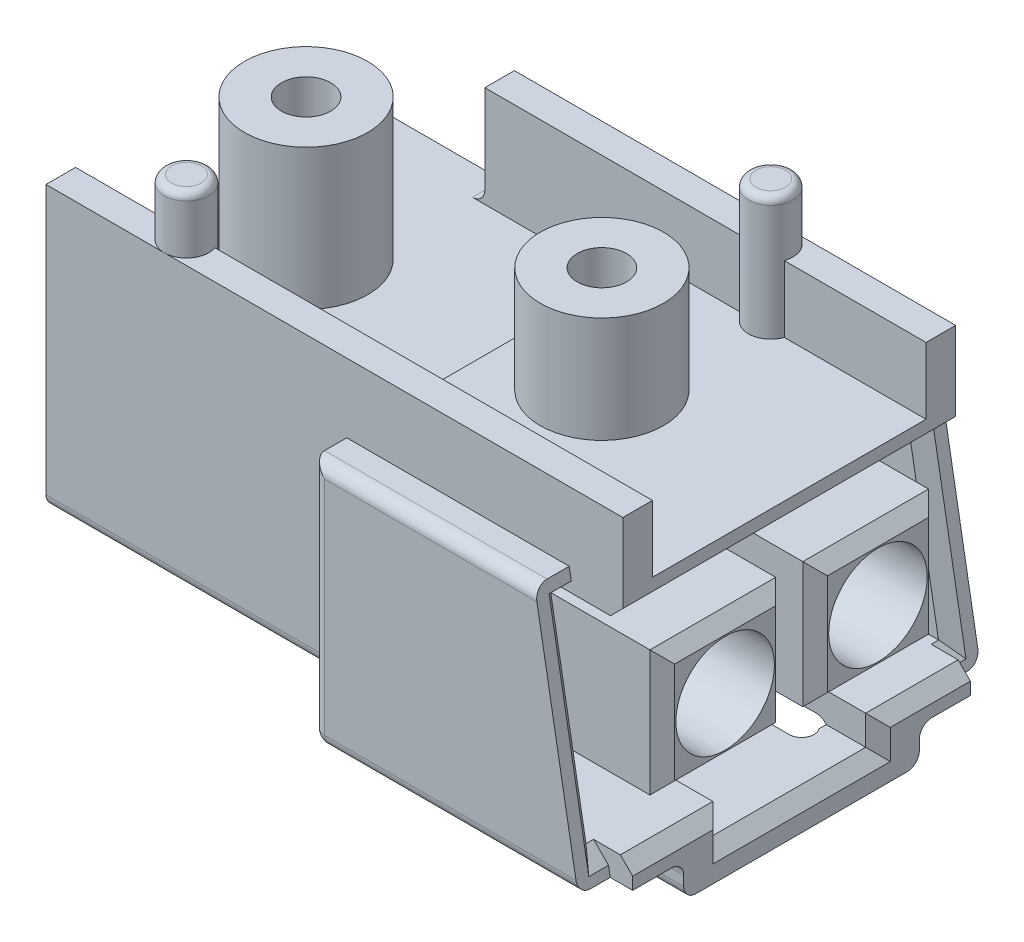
SolidWorks part; units mm, degrees
ref_plane "Front Plane" through (0, 0, 0) normal (0, 0, 1) x (1, 0, 0)
ref_plane "Top Plane" through (0, 0, 0) normal (0, 1, 0) x (1, 0, 0)
ref_plane "Right Plane" through (0, 0, 0) normal (1, 0, 0) x (0, 0, -1)
sketch "Sketch1" plane through (0, 0, 0) normal (0, 0, 1) x (1, 0, 0)
  line L0 (7.1, 7.7) -> (7.1, 0)
  line L1 (-7.1, 7.3) -> (5.1, 7.3)
  line L2 (-7.1, 7.3) -> (-7.1, 0)
  line L3 (7.1, 0) -> (-7.1, 0)
  line L4 (16.3, 7.7) -> (7.1, 7.7)
  line L5 (5.1, 8.7) -> (16.3, 8.7)
  line L6 (16.3, 8.7) -> (16.3, 7.7)
  line L7 (5.1, 8.7) -> (5.1, 7.3)
  dimension "D1" = 14.2
  dimension "D2" = 7.3
  dimension "D3" = 7.7
  dimension "D4" = 1.4
  dimension "D5" = 12.2
  dimension "D6" = 11.2
extrude "Extrude1" add sketch "Sketch1" against normal blind 6.75
chamfer "Chamfer1" distance 0.5 angle 45 1 edges at (16.3, 7.7, -3.375)
sketch "Sketch2" plane through (7.1, 0, 0) normal (1, 0, 0) x (0, 0, -1)
  line L0 (5.65, 6.2) -> (0.55, 6.2)
  line L1 (5.65, 1.1) -> (5.65, 6.2)
  line L2 (0.55, 1.1) -> (5.65, 1.1)
  line L3 (0.55, 6.2) -> (0.55, 1.1)
  line L4 (0, 0) -> (0, 7.7) construction
  line L5 (6.75, 7.7) -> (0, 7.7) construction
  dimension "D1" = 5.1
  dimension "D2" = 5.1
  dimension "D3" = 0.55
  dimension "D4" = 1.5
extrude "Extrude2" add sketch "Sketch2" along normal blind 9.7
chamfer "Chamfer2" distance 0.5 angle 45 4 edges at (16.8, 1.1, -3.1) (16.8, 3.65, -5.65) (16.8, 6.2, -3.1) (16.8, 3.65, -0.55)
ref_plane "Plane1" through (0, 0, -3.1) normal (0, 0, 1) x (1, 0, 0)
sketch "Sketch4" plane through (0, 0, -3.1) normal (0, 0, 1) x (1, 0, 0)
  line L0 (-7.1, 3.65) -> (16.8, 3.65) construction
  line L1 (-7.1, 0.95) -> (2.35, 0.95)
  line L2 (2.35, 0.95) -> (3.4, 2)
  line L3 (5.8, 2.085) -> (6.05, 2.335)
  line L4 (3.4, 2) -> (5.8, 2)
  line L5 (6.05, 2.335) -> (7.95, 2.335)
  line L6 (7.95, 1.65) -> (7.95, 2.335)
  line L7 (7.95, 1.65) -> (16.8, 1.65)
  line L8 (5.8, 2) -> (5.8, 2.085)
  line L9 (16.8, 5.7) -> (16.8, 1.6) construction
  line L10 (-7.1, 0.95) -> (-7.1, 3.65)
  line L11 (16.8, 1.65) -> (16.8, 3.65)
  line L12 (16.8, 3.65) -> (-7.1, 3.65)
  dimension "D1" = 2
  dimension "D3" = 8.85
  dimension "D4" = 0.685
  dimension "D5" = 1.9
  dimension "D6" = 45
  dimension "D7" = 0.3536
  dimension "D8" = 0.085
  dimension "D9" = 2.4
  dimension "D10" = 45
  dimension "D11" = 1.4849
  dimension "D12" = 9.45
revolve "Cut-Revolve1" cut sketch "Sketch4" angle 360 about L0
sketch "Sketch5" plane through (5.1, 0, 0) normal (-1, 0, 0) x (0, 0, 1)
  line L0 (-3.1, -1.401) -> (-8.15, -1.401)
  line L1 (-8.15, 8.6) -> (-8.15, -1.401)
  line L2 (-6.75, 8.6) -> (-8.15, 8.6)
  line L3 (-3.1, 3.65) -> (-3.1, -1.401) construction
  line L4 (-3.1, -1.401) -> (-3.1, 0)
  line L5 (-6.75, 0) -> (0, 0) construction
  line L6 (-3.1, 0) -> (-6.75, 0)
  line L7 (-6.75, 0) -> (-6.75, 7.7) construction
  line L8 (-6.75, 8.6) -> (-6.75, 0)
  circle A0 centre (-3.1, 3.65) radius 1.315 construction
  dimension "D1" = 1.4
  dimension "D2" = 5.051
  dimension "D3" = 5.05
  dimension "D4" = 10.001
extrude "Extrude3" add sketch "Sketch5" against normal up to surface (2 mm away)
sketch "Sketch6" plane through (0, 8.7, 0) normal (0, 1, 0) x (1, 0, 0)
  line L0 (14.1073, 0) -> (14.1073, 6.75) construction
  line L1 (16.3, 0) -> (5.1, 0) construction
  line L2 (16.3, 6.75) -> (5.1, 6.75) construction
  line L3 (16.3, 6.75) -> (16.3, 0) construction
  dimension "D1" = 2.1927
ref_plane "Plane2" through (15.1697, 2.6748, 0) normal (0.9848, 0.1736, 0) x (0, 0, -1)
sketch "Sketch8" plane through (7.1, 0, 0) normal (1, 0, 0) x (0, 0, -1)
  line L0 (8.15, -1.401) -> (3.1, -1.401) construction
  line L1 (8.15, 8.6) -> (8.15, -1.401) construction
  line L2 (6.75, 8.6) -> (8.15, 8.6) construction
  line L4 (8.15, -1.401) -> (3.1, -1.401)
  line L5 (8.15, 8.6) -> (8.15, -1.401)
  line L6 (6.75, 8.6) -> (8.15, 8.6)
  line L7 (6.75, 8.6) -> (6.75, 7.7)
  line L8 (3.1, -1.401) -> (3.1, -0.4)
  line L10 (3.1, -0.4) -> (7.15, -0.4)
  line L11 (3.1, 0) -> (0, 0) construction
  line L12 (6.75, 7.7) -> (7.15, 7.7)
  line L13 (7.15, 7.7) -> (7.15, -0.4)
  dimension "D1" = 0.4
  dimension "D2" = 0.4
extrude "Extrude5" add sketch "Sketch8" along normal up to surface (7.0249 mm away)
sketch "Sketch9" plane through (0, 0, -6.75) normal (0, 0, -1) x (-1, 0, 0)
  line L0 (-16.3, 8.7) -> (-16.3, 11.4)
  line L1 (-16.3, 11.4) -> (7.1, 11.4)
  line L2 (7.1, 11.4) -> (7.1, 7.3)
  line L3 (7.1, 7.3) -> (-5.1, 7.3)
  line L4 (-5.1, 7.3) -> (-5.1, 8.7)
  line L5 (-5.1, 8.7) -> (-16.3, 8.7)
  dimension "D1" = 2.7
extrude "Extrude6" add sketch "Sketch9" against normal blind 1.2
sketch "Sketch10" plane through (16.8, 0, 0) normal (1, 0, 0) x (0, 0, -1)
  line L0 (3.1, -0.4) -> (6.85, -0.4)
  line L1 (3.1, -0.4) -> (3.1, -1.6)
  line L2 (0, -1.6) -> (3.1, -1.6)
  line L3 (4.7801, -1.401) -> (6.85, -1.401)
  line L4 (4.7801, -1.401) -> (4.7801, -2.8)
  line L5 (0, -2.8) -> (4.7801, -2.8)
  line L6 (6.85, -0.4) -> (6.85, -1.401)
  line L7 (0, -1.6) -> (0, -2.8)
  line L8 (0, 0) -> (0, 7.7) construction
  line L9 (3.1, -1.401) -> (8.15, -1.401) construction
  point P10 (0, 0)
  dimension "D1" = 3.75
  dimension "D2" = 1.2
  dimension "D3" = 4.7801
  dimension "D4" = 1.2
extrude "Extrude7" add sketch "Sketch10" against normal blind 2
sketch "Sketch11" plane through (0, 0, 0) normal (0, 0, 1) x (1, 0, 0)
  line L0 (16.8, -1.6) -> (16.8, -2.8)
  line L1 (11.25, -1.6) -> (16.8, -1.6)
  line L2 (8.2, -1.6) -> (8.75, -1.6)
  line L3 (8.2, -1.6) -> (8.2, -2.8)
  line L4 (16.8, -2.8) -> (8.2, -2.8)
  arc A0 (11.25, -1.6) -> (8.75, -1.6) centre (10, -2.1766) ccw
  dimension "D3" = 1.3766
  dimension "D1" = 8.6
  dimension "D2" = 1.2
  dimension "D4" = 0.6234
  dimension "D5" = 1.8
  dimension "D6" = 0.55
extrude "Extrude8" add sketch "Sketch11" against normal blind 2
fillet "Fillet1" radius 0.5 12 edges at (10.4942, -1.401, -8.15) (5.1, -1.401, -5.625) (5.1, 3.5995, -8.15) (9.6124, 8.6, -8.15) (14.8, -2.8, -3.3901) (15.8, -2.8, -4.7801) (14.8, -2.1005, -4.7801) (14.8, -2.2, -2) (11.5, -2.8, -2) (8.2, -2.2, -2) (8.2, -2.8, -1) (-1, 0, -6.75)
fillet "Fillet2" radius 0.5 3 edges at (14.8, -1.401, -3.6901) (14.9464, -1.401, -4.6337) (16.05, -1.401, -4.7801)
chamfer "Chamfer4" distance 0.5 angle 45 6 edges at (15.7118, -0.4, -7) (14.2836, 7.7, -6.95) (14.9977, 3.65, -7.15) (16.8, -1.6, -1.55) (16.8, -1, -3.1) (16.8, -0.4, -4.975)
sketch "Sketch13" plane through (0, 7.3, 0) normal (0, 1, 0) x (1, 0, 0)
  line L1 (5.1, 0) -> (-7.1, 0) construction
  line L2 (-7.1, 5.55) -> (-7.1, 0) construction
  line L3 (-0.8, 0) -> (-2.3, 0)
  line L4 (-4.3, 0) -> (-5.8, 0)
  arc A0 (-0.8, 0) -> (-5.8, 0) centre (-3.3, 0) ccw
  arc A1 (-2.3, 0) -> (-4.3, 0) centre (-3.3, 0) ccw
  dimension "D1" = 5
  dimension "D3" = 2
  dimension "D2" = 3.8
extrude "Extrude9" add sketch "Sketch13" along normal blind 5.7
sketch "Sketch14" plane through (0, 8.7, 0) normal (0, 1, 0) x (1, 0, 0)
  line L0 (16.3, 0) -> (5.1, 0) construction
  line L1 (5.1, 5.55) -> (5.1, 0) construction
  line L2 (11.2, 0) -> (9.7, 0)
  line L3 (7.7, 0) -> (6.2, 0)
  arc A0 (11.2, 0) -> (6.2, 0) centre (8.7, 0) ccw
  arc A1 (9.7, 0) -> (7.7, 0) centre (8.7, 0) ccw
  dimension "D2" = 5
  dimension "D3" = 2
  dimension "D1" = 3.6
extrude "Extrude10" add sketch "Sketch14" along normal blind 4.3
mirror "Mirror1" about plane through (0, 0, 0) normal (0, 0, 1)
sketch "Sketch15" plane through (0, 0, -6.75) normal (0, 0, -1) x (-1, 0, 0)
  line L0 (-5.1, 7.3) -> (7.1, 7.3) construction
  line L1 (-5.1, 7.3) -> (7.1, 7.3) construction
  line L2 (7.1, 7.3) -> (1.6, 7.3)
  line L3 (1.6, 7.3) -> (1.6, 11.4)
  line L5 (7.1, 11.4) -> (-16.3, 11.4) construction
  line L6 (1.6, 11.4) -> (7.1, 11.4)
  line L7 (7.1, 11.4) -> (7.1, 7.3)
  dimension "D1" = 5.5
extrude "Cut-Extrude1" cut sketch "Sketch15" against normal up to surface (1.2 mm away)
fillet "Fillet3" radius 0.5 1 edges at (-1.6, 7.3, -6.15)
sketch "Sketch16" plane through (0, 7.3, 0) normal (0, 1, 0) x (1, 0, 0)
  line L0 (-7.1, -6.75) -> (16.3, -6.75) construction
  line L1 (-7.1, 6.75) -> (-7.1, -5.55) construction
  circle A0 centre (-2.3, -5.85) radius 0.9
  dimension "D1" = 1.8
  dimension "D2" = 0.9
  dimension "D3" = 4.8
extrude "Extrude11" add sketch "Sketch16" along normal blind 6.4
sketch "Sketch17" plane through (0, 8.7, 0) normal (0, 1, 0) x (1, 0, 0)
  line L0 (-1.6, 6.75) -> (16.3, 6.75) construction
  line L1 (16.3, 5.55) -> (16.3, 6.75) construction
  circle A0 centre (9.7, 5.85) radius 0.9
  dimension "D1" = 1.8
  dimension "D2" = 0.9
  dimension "D3" = 6.6
extrude "Extrude12" add sketch "Sketch17" along normal blind 5
fillet "Fillet4" radius 0.3 2 edges at (8.8, 13.7, -5.85) (-3.2, 13.7, 5.85)
